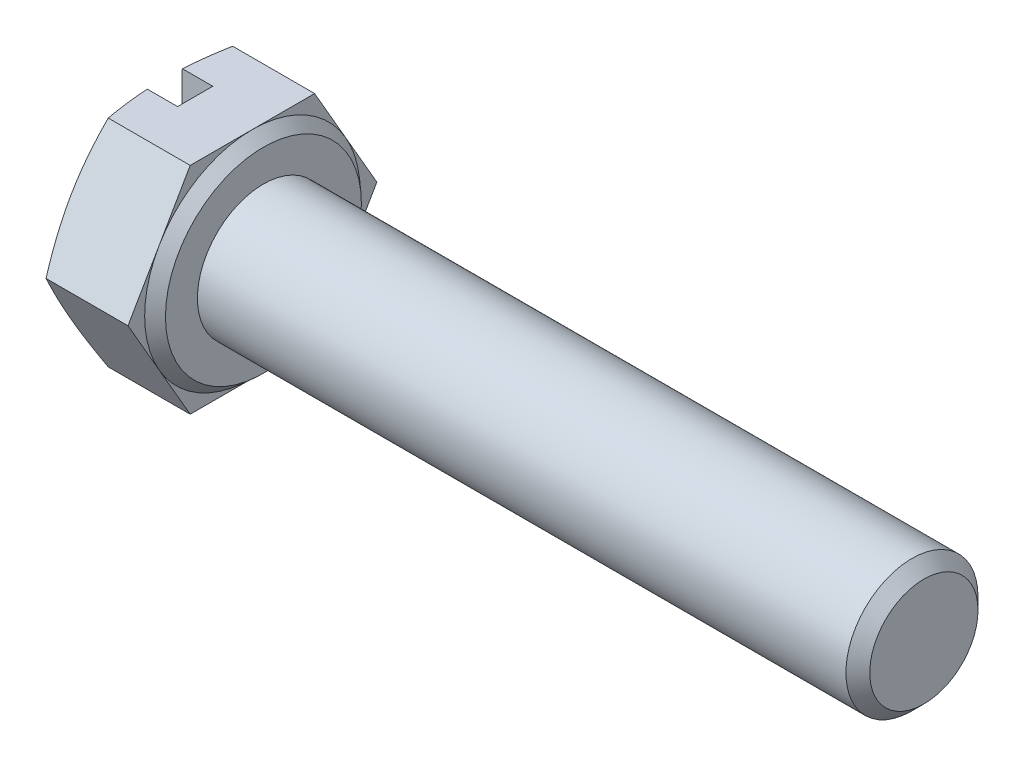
SolidWorks part; units mm, degrees
ref_plane "Front" through (0, 0, 0) normal (0, 0, 1) x (1, 0, 0)
ref_plane "Top" through (0, 0, 0) normal (0, 1, 0) x (1, 0, 0)
ref_plane "Right" through (0, 0, 0) normal (1, 0, 0) x (0, 0, -1)
sketch "Sketch-BaseHead" plane through (0, 0, 0) normal (1, 0, 0) x (0, 0, -1)
  line L1 (2.8261, -4.895) -> (5.6523, 0)
  line L2 (5.6523, 0) -> (2.8261, 4.895)
  line L3 (2.8261, 4.895) -> (-2.8261, 4.895)
  line L4 (-2.8261, 4.895) -> (-5.6523, 0)
  line L5 (-5.6523, 0) -> (-2.8261, -4.895)
  line L6 (-2.8261, -4.895) -> (2.8261, -4.895)
  circle A0 centre (0, 0) radius 4.895 construction
  dimension "s" = 9.79
extrude "BaseHead" add sketch "Sketch-BaseHead" along normal blind 4
ref_plane "Plane1" through (4.5, 0, 0) normal (1, 0, 0) x (0, 0, -1)
sketch "Sketch1" plane through (0, 0, 0) normal (0, 0, 1) x (1, 0, 0)
  line L0 (4, 0) -> (4.5, 0)
  line L1 (4.5, 0) -> (4.5, -4.45)
  line L2 (4.5, -4.45) -> (4, -4.895)
  line L3 (4, -4.895) -> (4, 0)
  dimension "D1" = 4.895
  dimension "D2" = 0.5
  dimension "D3" = 4.45
revolve "Revolve1" add sketch "Sketch1" angle 360 about axis through (-4.0016, 0, 0) along (1, 0, 0)
sketch "Sketch3" plane through (4.5, 0, 0) normal (1, 0, 0) x (0, 0, -1)
  circle A0 centre (0, 0) radius 3
  dimension "d" = 6
extrude "BaseBody" add sketch "Sketch3" along normal blind 30
chamfer "Chamfer1" distance 0.5415 angle 45 1 edges at (34.5, 0, -3)
fillet "HeadFillet" [suppressed] radius 0.25
sketch "Sketch4" plane through (-0.2646, 0, 5.9169) normal (0, 1, 0) x (0, 0, -1)
  line L0 (5.9169, 3.7369) -> (5.9169, -10.4477) construction
  line L2 (11.5692, -0.2646) -> (10.8119, -0.2646)
  line L4 (10.8119, -0.2646) -> (11.5692, -0.5403)
  line L6 (11.5692, -0.5403) -> (11.5692, -0.2646)
  dimension "D1" = 20
  dimension "D2" = 9.79
revolve "HeadChamfer" cut sketch "Sketch4" angle 360 about L0
sketch "Sketch5" plane through (0, 0, 0) normal (0, 1, 0) x (1, 0, 0)
  line L0 (0, 0.8) -> (0, -0.8)
  line L1 (1.4, -0.8) -> (1.4, 0.8)
  line L2 (1.4, 0.8) -> (0, 0.8)
  line L3 (0, -0.8) -> (1.4, -0.8)
  dimension "n" = 1.6
  dimension "t" = 1.4
extrude "Slot" cut sketch "Sketch5" against normal through all and the other way through all
sketch "Sketch6" plane through (0, 0, 0) normal (0, 0, 1) x (1, 0, 0)
  line L0 (4.5, 3.2) -> (5.0415, 3.2)
  line L1 (5.0415, 3.2) -> (5.0415, 3)
  line L2 (5.0415, 3) -> (4.7708, 2.531)
  line L3 (4.5, 3) -> (4.7708, 2.531)
  line L4 (4.5, 3.2) -> (4.5, 3)
  line L5 (14.0487, 0) -> (0, 0) construction
  line L6 (4.5, 3) -> (5.0415, 3) construction
  line L7 (4.7708, 3) -> (4.7708, 2.531) construction
  point P5 (4.7708, 3.2)
  dimension "D1" = 0.2
  dimension "D2" = 0.5415
revolve "Cut-Revolve10" [suppressed] cut sketch "Sketch6" angle 360 about L5
pattern_linear "LPattern10" [suppressed] count 46 spacing 0.6498
equation "\"D1@Sketch1\" = \"s@Sketch-BaseHead\"/ 2 "
equation "\"D2@Sketch4\" = \"s@Sketch-BaseHead\""
equation "\"D1@Chamfer1\" =  ( \"d@Sketch3\" - \"D2@ThreadCosmetic1\" ) / 2 "
equation "\"D2@Sketch6\" = (  \"d@Sketch3\" - \"D2@ThreadCosmetic1\" )  / 2"
equation "\"D3@LPattern10\" = \"D2@Sketch6\" * 1.2"
equation "\"D1@LPattern10\" = \"l@BaseBody\" / \"D3@LPattern10\""
